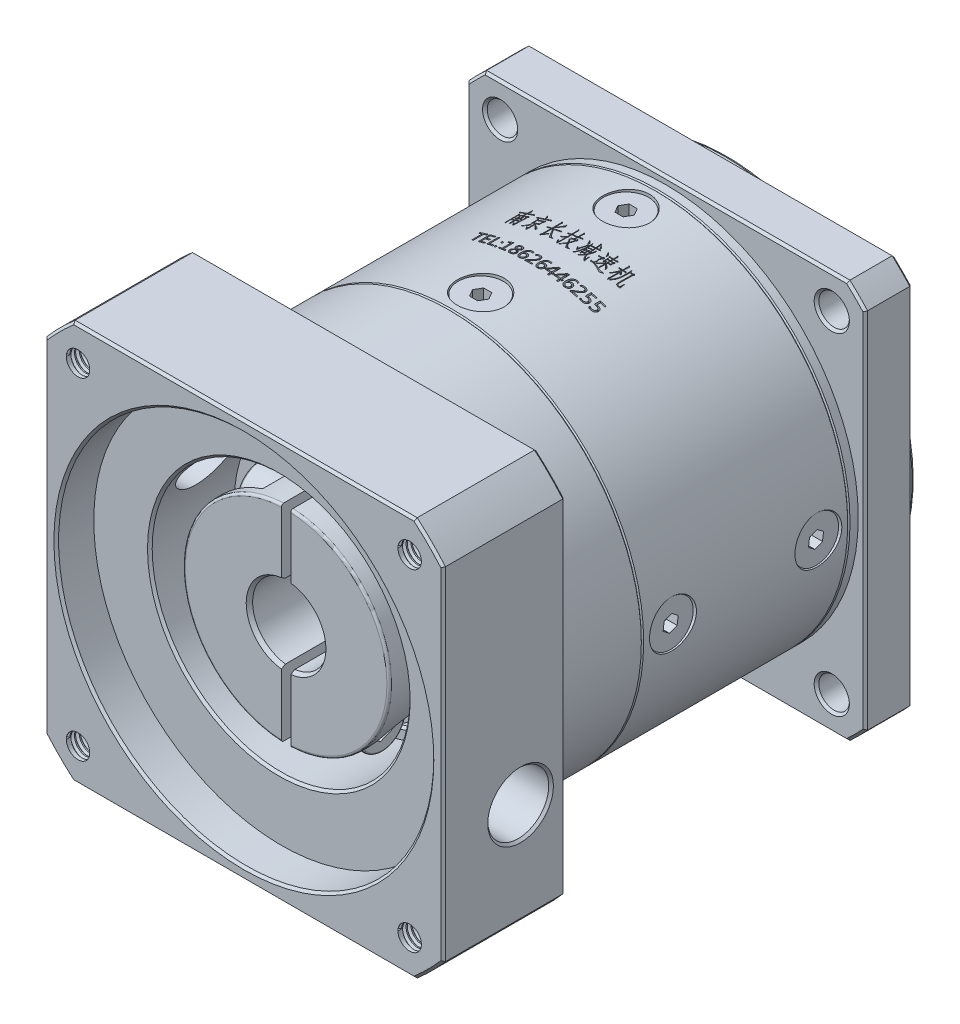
SolidWorks part; units mm, degrees
ref_plane "前视基准面" through (0, 0, 0) normal (0, 0, 1) x (1, 0, 0)
ref_plane "上视基准面" through (0, 0, 0) normal (0, 1, 0) x (1, 0, 0)
ref_plane "右视基准面" through (0, 0, 0) normal (1, 0, 0) x (0, 0, -1)
imported_body "16-80-100-M6-1-solid1"
imported_body "16-80-100-M6-1-solid2"
imported_body "16-80-100-M6-1-solid3"
imported_body "16-80-100-M6-1-solid4"
imported_body "ZF80-K15-L1-5-solid1"
imported_body "ZF80-K15-L1-5-solid2"
imported_body "ZF80-K15-L1-5-solid3"
imported_body "ZF80-K15-L1-5-solid4"
imported_body "ZF80-K15-L1-5-solid5"
imported_body "ZF80-K15-L1-5-solid6"
imported_body "ZF80-K15-L1-5-solid7"
imported_body "ZF80-K15-L1-5-solid8"
imported_body "ZF80-K15-L1-5-solid9"
sketch "草图1" plane through (0, 0, -54.7125) normal (0, 0, -1) x (-1, 0, 0)
  circle A0 centre (88.8934, 24.356) radius 11.304
  dimension "D1" = 22.608
extrude "凸台-拉伸1" add sketch "草图1" along normal blind 5
